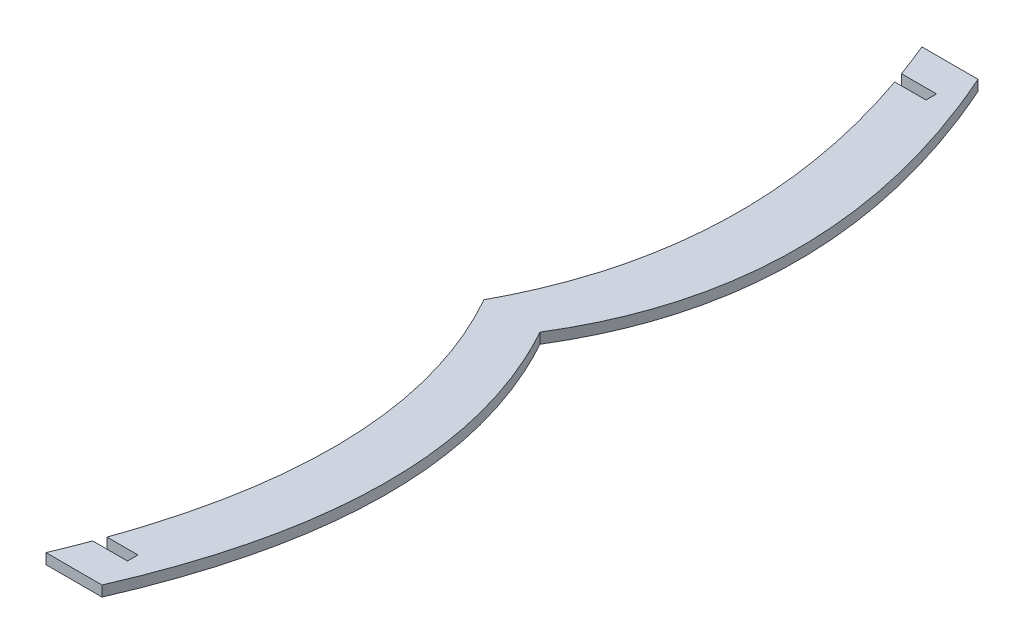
SolidWorks part; units mm, degrees
ref_plane "Front Plane" through (0, 0, 0) normal (0, 0, 1) x (1, 0, 0)
ref_plane "Top Plane" through (0, 0, 0) normal (0, 1, 0) x (1, 0, 0)
ref_plane "Right Plane" through (0, 0, 0) normal (1, 0, 0) x (0, 0, -1)
sketch "Sketch1" plane through (0, 0, 0) normal (0, 1, 0) x (1, 0, 0)
  line L1 (0, 132.9624) -> (16, 132.9624)
  line L2 (0, -117.0376) -> (16, -117.0376)
  spline S1 degree 2 poles (0, 132.9624) (29.311, 62.1066) (0, 7.9624) knots 0 0 0 0.889396 0.889396 0.889396
  spline S2 degree 2 poles (0, -117.0376) (30.0897, -45.5213) (0, 7.9624) knots 0 0 0 0.875473 0.875473 0.875473
  spline S3 degree 2 poles (16, 132.9624) (48.23, 60.3187) (16, 7.9624) knots 0 0 0 0.900398 0.900398 0.900398
  spline S4 degree 2 poles (16, -117.0376) (46.3473, -47.1465) (16, 7.9624) knots 0 0 0 0.67933 0.67933 0.67933
  dimension "D1" = 250
  dimension "D2" = 16
  dimension "D3" = 16
extrude "Boss-Extrude1" add sketch "Sketch1" along normal blind 3
sketch "Sketch2" plane through (0, 3, 0) normal (0, 1, 0) x (1, 0, 0)
  line L1 (3.711, 123.4151) -> (13.711, 123.4151)
  line L2 (3.711, 123.4151) -> (3.711, 120.4151)
  line L3 (3.711, 120.4151) -> (13.711, 120.4151)
  line L4 (13.711, 123.4151) -> (13.711, 120.4151)
  line L5 (13.711, -107.4902) -> (13.711, -104.4902)
  line L10 (3.711, -104.4902) -> (13.711, -104.4902)
  line L11 (3.711, -107.4902) -> (3.711, -104.4902)
  line L12 (3.711, -107.4902) -> (13.711, -107.4902)
  parabola Q0 construction
  dimension "D1" = 3
  dimension "D2" = 10
extrude "Cut-Extrude1" cut sketch "Sketch2" against normal blind 39.71
